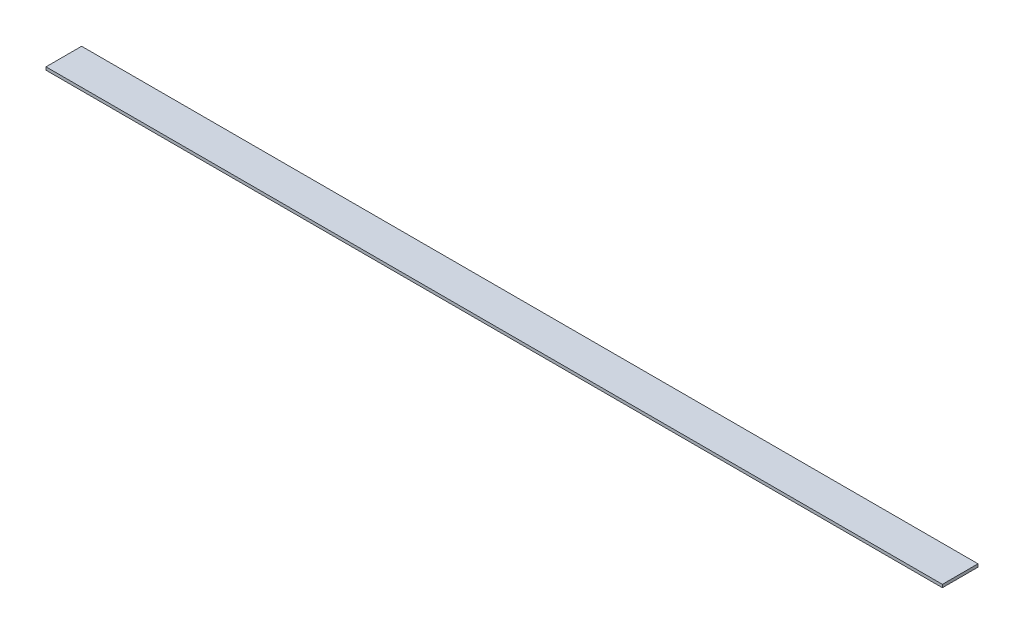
SolidWorks part; units mm, degrees
ref_plane "Plan de face" through (0, 0, 0) normal (0, 0, 1) x (1, 0, 0)
ref_plane "Plan de dessus" through (0, 0, 0) normal (0, 1, 0) x (1, 0, 0)
ref_plane "Plan de droite" through (0, 0, 0) normal (1, 0, 0) x (0, 0, -1)
ref_plane "Plan1" through (0, 0, 0) normal (0, -1, 0) x (1, 0, 0)
sketch "Esquisse1" plane through (0, 0, 0) normal (0, -1, 0) x (1, 0, 0)
  line L0 (75.5, -3) -> (75.5, 3)
  line L1 (75.5, 3) -> (-75.5, 3)
  line L2 (-75.5, 3) -> (-75.5, -3)
  line L3 (-75.5, -3) -> (75.5, -3)
extrude "Boss.-Extru.1" add sketch "Esquisse1" against normal blind 0.5
